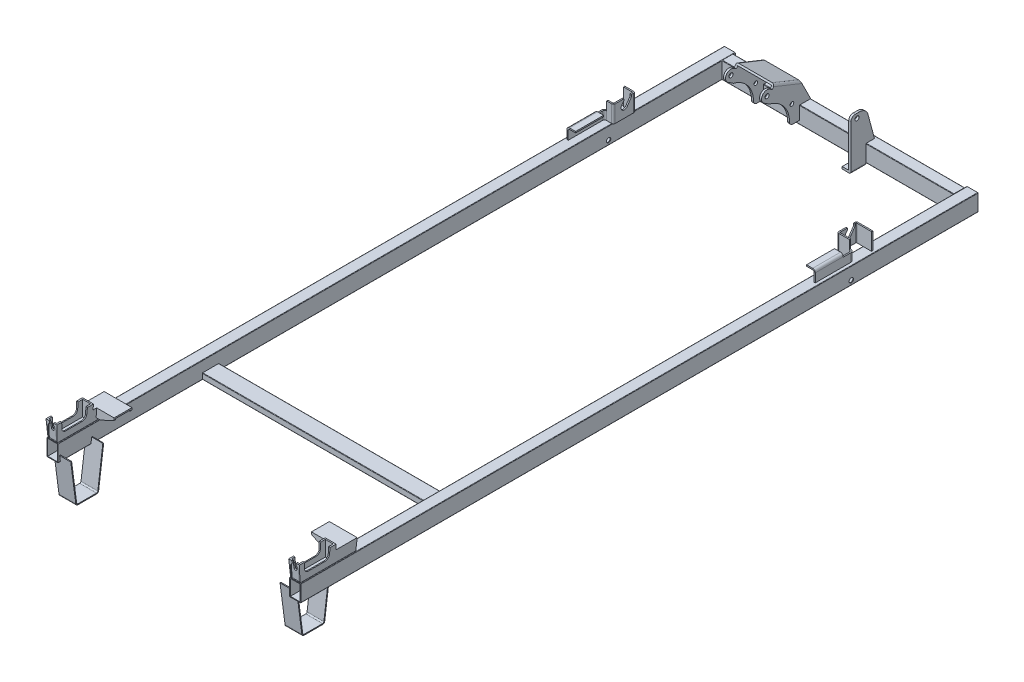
SolidWorks part; units mm, degrees
ref_plane "Plan de face" through (0, 0, 0) normal (0, 0, 1) x (1, 0, 0)
ref_plane "Plan de dessus" through (0, 0, 0) normal (0, 1, 0) x (1, 0, 0)
ref_plane "Plan de droite" through (0, 0, 0) normal (1, 0, 0) x (0, 0, -1)
sketch "Esquisse1" plane through (0, 0, 0) normal (0, 0, 1) x (1, 0, 0)
  line L1 (-11.75, -19.25) -> (11.75, -19.25)
  line L2 (-12.75, -18.25) -> (-12.75, 18.25)
  line L3 (-11.75, 19.25) -> (11.75, 19.25)
  line L4 (12.75, -18.25) -> (12.75, 18.25)
  arc A0 (-12.75, 18.25) -> (-11.75, 19.25) centre (-11.75, 18.25) cw
  arc A1 (11.75, 19.25) -> (12.75, 18.25) centre (11.75, 18.25) cw
  arc A2 (11.75, -19.25) -> (12.75, -18.25) centre (11.75, -18.25) ccw
  arc A3 (-11.75, -19.25) -> (-12.75, -18.25) centre (-11.75, -18.25) cw
  point P7 (-12.75, 19.25)
  point P10 (12.75, 19.25)
  point P13 (12.75, -19.25)
  dimension "D5" = 1
  dimension "D1" = 25.5
  dimension "D2" = 38.5
  dimension "D3" = 12.75
  dimension "D4" = 19.25
extrude "Longueur" add sketch "Esquisse1" against normal blind 1550 thin
sketch "Esquisse2" plane through (12.75, 0, 0) normal (1, 0, 0) x (0, 0, -1)
  line L0 (1550, 19.25) -> (0, 19.25) construction
  line L1 (1544, 19.25) -> (1520.5, 19.25)
  line L2 (1545, 18.25) -> (1545, -18.25)
  line L3 (1544, -19.25) -> (1520.5, -19.25)
  line L4 (1519.5, 18.25) -> (1519.5, -18.25)
  line L5 (1550, -19.25) -> (0, -19.25) construction
  line L7 (1550, -18.25) -> (1550, 18.25) construction
  arc A0 (1520.5, 19.25) -> (1519.5, 18.25) centre (1520.5, 18.25) ccw
  arc A1 (1544, 19.25) -> (1545, 18.25) centre (1544, 18.25) cw
  arc A2 (1545, -18.25) -> (1544, -19.25) centre (1544, -18.25) cw
  arc A3 (1520.5, -19.25) -> (1519.5, -18.25) centre (1520.5, -18.25) cw
  point P12 (1519.5, 19.25)
  point P15 (1545, 19.25)
  point P20 (1519.5, -19.25)
  dimension "D3" = 1
  dimension "D1" = 5
  dimension "D2" = 25.5
extrude "Largeur" add sketch "Esquisse2" along normal blind 265 thin
sketch "Esquisse4" plane through (12.75, 0, 0) normal (1, 0, 0) x (0, 0, -1)
  line L0 (77, -19.25) -> (67.1761, -94.8939)
  line L1 (1550, -19.25) -> (0, -19.25) construction
  line L2 (62.2178, -99.25) -> (19.7822, -99.25)
  line L3 (14.8239, -94.8939) -> (3.3117, -6.25)
  line L4 (5, 28.054) -> (5, -42.7395) construction
  line L5 (0, 18.25) -> (0, -18.25) construction
  line L6 (41, -99.25) -> (41, -19.25) construction
  line L7 (77, -19.25) -> (78.6883, -6.25)
  arc A0 (62.2178, -99.25) -> (67.1761, -94.8939) centre (62.2178, -94.25) ccw
  arc A1 (19.7822, -99.25) -> (14.8239, -94.8939) centre (19.7822, -94.25) cw
  point P10 (5, -19.25)
  point P18 (0, 19.25)
  dimension "D5" = 5
  dimension "D1" = 5
  dimension "D2" = 72
  dimension "D3" = 80
  dimension "D4" = 93
extrude "Pied arrière" add sketch "Esquisse4" along normal blind 25.5 thin
sketch "Esquisse5" plane through (12.75, 0, 0) normal (-1, 0, 0) x (0, 0, 1)
  line L8 (-14.8239, -94.8939) -> (-4.8701, -18.25)
  line L9 (-4.8701, -18.25) -> (-6.8869, -18.25)
  line L10 (-6.8869, -18.25) -> (-16.8072, -94.6364)
  line L11 (-19.7822, -97.25) -> (-62.2178, -97.25)
  line L12 (-65.1928, -94.6364) -> (-75.1131, -18.25)
  line L13 (-4.8701, -18.25) -> (-6.8869, -18.25)
  line L14 (-77.1299, -18.25) -> (-67.1761, -94.8939)
  line L15 (-62.2178, -99.25) -> (-19.7822, -99.25)
  line L16 (-14.8239, -94.8939) -> (-4.8701, -18.25)
  line L17 (-75.1131, -18.25) -> (-77.1299, -18.25)
  line L18 (-6.8869, -18.25) -> (-16.8072, -94.6364)
  line L19 (-19.7822, -97.25) -> (-62.2178, -97.25)
  line L20 (-65.1928, -94.6364) -> (-75.1131, -18.25)
  line L21 (-75.1131, -18.25) -> (-77.1299, -18.25)
  line L22 (-77.1299, -18.25) -> (-67.1761, -94.8939)
  line L23 (-62.2178, -99.25) -> (-19.7822, -99.25)
  arc A4 (-19.7822, -97.25) -> (-16.8072, -94.6364) centre (-19.7822, -94.25) ccw
  arc A5 (-65.1928, -94.6364) -> (-62.2178, -97.25) centre (-62.2178, -94.25) ccw
  arc A6 (-67.1761, -94.8939) -> (-62.2178, -99.25) centre (-62.2178, -94.25) ccw
  arc A7 (-19.7822, -99.25) -> (-14.8239, -94.8939) centre (-19.7822, -94.25) ccw
  arc A8 (-19.7822, -97.25) -> (-16.8072, -94.6364) centre (-19.7822, -94.25) ccw
  arc A9 (-65.1928, -94.6364) -> (-62.2178, -97.25) centre (-62.2178, -94.25) ccw
  arc A10 (-67.1761, -94.8939) -> (-62.2178, -99.25) centre (-62.2178, -94.25) ccw
  arc A11 (-19.7822, -99.25) -> (-14.8239, -94.8939) centre (-19.7822, -94.25) ccw
  dimension "D1" = 0
extrude "Pied arrière2" add sketch "Esquisse5" along normal blind 13
sketch "Esquisse6" plane through (0, 0, 0) normal (1, 0, 0) x (0, 0, -1)
  line L0 (0, 19.25) -> (-2.6572, 57.25)
  line L1 (129.8181, 45.25) -> (80.8181, 45.25)
  line L2 (129.8181, 45.25) -> (128, 19.25)
  line L3 (1519.5, 19.25) -> (0, 19.25) construction
  line L4 (128, 19.25) -> (0, 19.25)
  line L5 (80.8181, 45.25) -> (80.8181, 57.25)
  line L6 (80.8181, 57.25) -> (67.3428, 57.25)
  line L7 (67.3428, 57.25) -> (66.385, 43.5524)
  line L8 (56.4093, 34.25) -> (19.2762, 34.25)
  line L9 (9.3006, 43.5524) -> (8.3428, 57.25)
  line L10 (8.3428, 57.25) -> (-2.6572, 57.25)
  line L11 (128, 19.25) -> (128, 80.5547) construction
  line L12 (0, 19.25) -> (0, 131.9278) construction
  arc A0 (19.2762, 34.25) -> (9.3006, 43.5524) centre (19.2762, 44.25) cw
  arc A1 (56.4093, 34.25) -> (66.385, 43.5524) centre (56.4093, 44.25) ccw
  dimension "D10" = 10
  dimension "D1" = 128
  dimension "D2" = 26
  dimension "D3" = 49
  dimension "D4" = 38
  dimension "D5" = 4
  dimension "D6" = 4
  dimension "D7" = 59
  dimension "D8" = 15
  dimension "D9" = 11
extrude "Extrusion1" add sketch "Esquisse6" along normal mid plane 21
draft "Dépouille2" type of draft neutral plane draft angle 3 faces to draft 2 parameters "D1"=3
sketch "Esquisse7" plane through (0, 0.0937, -1.3395) normal (0, -0.0698, 0.9976) x (1, 0, 0)
  line L0 (-9.5, 19.2031) -> (-9, 44.3818)
  line L1 (10.5, 19.2031) -> (-10.5, 19.2031) construction
  line L2 (9.5, 19.2031) -> (9, 44.3818)
  line L3 (0, 19.2031) -> (0, 49.1783) construction
  line L4 (9.5, 19.2031) -> (-9.5, 19.2031)
  arc A0 (9, 44.3818) -> (-9, 44.3818) centre (0, 44.2031) ccw
  dimension "D1" = 19
  dimension "D2" = 18
  dimension "D3" = 25
extrude "Enlèv. mat.-Extru.1" cut sketch "Esquisse7" against normal blind 2
sketch "Esquisse8" plane through (0, 0, 0) normal (1, 0, 0) x (0, 0, -1)
  line L0 (67.3428, 57.25) -> (66.385, 43.5524) construction
  line L1 (56.4093, 34.25) -> (19.2762, 34.25) construction
  line L2 (9.3006, 43.5524) -> (8.3428, 57.25) construction
  line L3 (67.3428, 57.25) -> (66.385, 43.5524)
  line L4 (56.4093, 34.25) -> (19.2762, 34.25)
  line L5 (9.3006, 43.5524) -> (8.3428, 57.25)
  line L6 (80.8181, 57.25) -> (67.3428, 57.25) construction
  line L7 (8.3428, 57.25) -> (-2.6572, 57.25) construction
  line L8 (77.8181, 57.25) -> (67.3428, 57.25)
  line L9 (8.3428, 57.25) -> (0.3501, 57.25)
  line L14 (77.8181, 57.25) -> (77.8181, 22.25)
  line L15 (0.3355, 57.4593) -> (2.9927, 19.4593)
  line L16 (0.3501, 57.25) -> (2.7975, 22.25)
  line L18 (80.8181, 45.25) -> (80.8181, 57.25) construction
  line L19 (1550, 22.25) -> (0, 22.25)
  line L20 (77.8181, 22.25) -> (2.7975, 22.25)
  arc A0 (56.4093, 34.25) -> (66.385, 43.5524) centre (56.4093, 44.25) ccw construction
  arc A1 (9.3006, 43.5524) -> (19.2762, 34.25) centre (19.2762, 44.25) ccw construction
  arc A2 (56.4093, 34.25) -> (66.385, 43.5524) centre (56.4093, 44.25) ccw
  arc A3 (9.3006, 43.5524) -> (19.2762, 34.25) centre (19.2762, 44.25) ccw
  dimension "D3" = 3
  dimension "D1" = 3
  dimension "D2" = 3
extrude "Support rouleau arrière" cut sketch "Esquisse8" against normal mid plane 18
sketch "Esquisse9" plane through (0, 0.3029, -4.3322) normal (0, 0.0698, -0.9976) x (-1, 0, 0)
  line L0 (-9, 57.0861) -> (-9, 22.0007) construction
  line L1 (9, 22.0007) -> (-9, 22.0007) construction
  line L2 (9, 57.0861) -> (9, 22.0007) construction
  line L3 (-9, 44.3818) -> (-9, 22.0007)
  line L4 (9, 22.0007) -> (-9, 22.0007)
  line L5 (9, 44.3818) -> (9, 22.0007)
  arc A0 (9, 44.3818) -> (-9, 44.3818) centre (0, 44.2031) ccw construction
  arc A1 (9, 44.3818) -> (-9, 44.3818) centre (0, 44.2031) ccw
extrude "Extrusion2" add sketch "Esquisse9" along normal blind 2
sketch "Esquisse12" plane through (0, 0, 0) normal (1, 0, 0) x (0, 0, -1)
  line L0 (3.6137, 39.25) -> (14.8024, 22.25)
  line L1 (3.2314, 44.7162) -> (4.7927, 22.3895) construction
  line L2 (2.7975, 22.25) -> (77.8181, 22.25) construction
  line L3 (14.8024, 22.25) -> (4.8024, 22.25)
  line L4 (3.6137, 39.25) -> (4.8024, 22.25)
  dimension "D1" = 17
  dimension "D2" = 10
extrude "Extrusion3" add sketch "Esquisse12" along normal mid plane 2
sketch "Esquisse13" plane through (0, 0.2332, -3.3347) normal (0, -0.0698, 0.9976) x (1, 0, 0)
  line L0 (5, 57.2959) -> (2.9756, 41.5205)
  line L1 (12.4915, 57.2959) -> (-12.4915, 57.2959) construction
  line L2 (-5, 57.2959) -> (-2.9756, 41.5205)
  line L3 (0, 57.2959) -> (0, 34.2193) construction
  line L4 (-5, 57.2959) -> (5, 57.2959)
  line L5 (1, 38.9023) -> (-1, 38.9023) construction
  arc A0 (-2.9756, 41.5205) -> (2.9756, 41.5205) centre (0, 41.9023) ccw
  dimension "D1" = 3
  dimension "D2" = 10
extrude "Enlèv. mat.-Extru.3" cut sketch "Esquisse13" against normal up to surface and the other way through all
sketch "Esquisse14" plane through (0, 45.25, 0) normal (0, 1, 0) x (1, 0, 0)
  line L0 (10.8626, 129.8181) -> (51.8626, 129.8181)
  line L2 (51.8626, 129.8181) -> (51.8626, 88.8181)
  line L3 (51.8626, 88.8181) -> (10.8626, 88.8181)
  line L7 (10.8626, 129.8181) -> (10.8626, 80.8181)
  line L8 (10.8626, 129.8181) -> (10.8626, 88.8181)
  dimension "D1" = 41
  dimension "D2" = 41
  dimension "D3" = 1
extrude "Extrusion4" add sketch "Esquisse14" against normal blind 3
sketch "Esquisse15" plane through (0, 0, -88.8181) normal (0, 0, 1) x (1, 0, 0)
  line L0 (12.4915, 57.25) -> (10.5, 19.25) construction
  line L1 (10.8144, 25.25) -> (20.8144, 25.25)
  line L2 (20.8144, 25.25) -> (51.8626, 40.25)
  line L3 (51.8626, 40.25) -> (51.8626, 42.25)
  line L4 (11.8626, 45.25) -> (51.8626, 45.25) construction
  line L5 (11.7054, 42.25) -> (51.8626, 42.25) construction
  line L6 (11.7054, 42.25) -> (51.8626, 42.25)
  line L7 (11.7054, 42.25) -> (10.8144, 25.25)
  dimension "D1" = 20
  dimension "D2" = 5
  dimension "D3" = 10
extrude "Extrusion5" add sketch "Esquisse15" against normal blind 3
ref_point "Point1"
ref_plane "Plan2" through (0, 0, -109.3181) normal (0, 0, -1) x (-1, 0, 0)
mirror "Symétrie2" about plane through (0, 0, -109.3181) normal (0, 0, -1) of "Extrusion5"
sketch "Esquisse17" plane through (10.8626, 0, 0) normal (-1, 0, 0) x (0, 0, 1)
  line L1 (-128.4196, 25.25) -> (-129.8181, 25.25) construction
  line L2 (-128.4196, 25.25) -> (-129.8181, 25.25)
  line L3 (-129.6083, 42.25) -> (-129.8181, 45.25)
  line L4 (-129.8181, 45.25) -> (-129.8181, 42.25)
  line L5 (-129.8181, 42.25) -> (-129.6083, 42.25)
  line L6 (-128.4196, 25.25) -> (-129.8181, 45.25)
  line L7 (-129.8181, 45.25) -> (-129.8181, 25.25)
  dimension "D1" = 0
extrude "Enlèv. mat.-Extru.4" cut sketch "Esquisse17" against normal through all and the other way through all
sketch "Esquisse18" plane through (12.75, 0, 0) normal (1, 0, 0) x (0, 0, -1)
  line L0 (0, -18.25) -> (0, 18.25) construction
  line L1 (331, -5.75) -> (367, -5.75)
  line L2 (330, -6.75) -> (330, -17.75)
  line L3 (331, -18.75) -> (367, -18.75)
  line L4 (368, -6.75) -> (368, -17.75)
  line L5 (1550, 19.25) -> (0, 19.25) construction
  arc A0 (331, -5.75) -> (330, -6.75) centre (331, -6.75) ccw
  arc A1 (367, -5.75) -> (368, -6.75) centre (367, -6.75) cw
  arc A2 (367, -18.75) -> (368, -17.75) centre (367, -17.75) ccw
  arc A3 (330, -17.75) -> (331, -18.75) centre (331, -17.75) ccw
  point P4 (0, 0)
  point P11 (330, -5.75)
  point P14 (368, -5.75)
  point P19 (330, -18.75)
  dimension "D5" = 1
  dimension "D1" = 330
  dimension "D2" = 25
  dimension "D3" = 13
  dimension "D4" = 38
extrude "Barre de renfort" add sketch "Esquisse18" along normal up to surface (265 mm away) thin
sketch "Esquisse19" plane through (0, 19.25, 0) normal (0, 1, 0) x (1, 0, 0)
  line L0 (-4.75, 1185) -> (-4.75, 1263)
  line L1 (0.25, 1268) -> (11.75, 1268)
  line L2 (15.75, 1272) -> (15.75, 1314)
  line L3 (11.75, 1318) -> (-8.25, 1318)
  line L4 (-9.5, 0) -> (9.5, 0) construction
  line L5 (-12.75, 1550) -> (-12.75, 0) construction
  line L6 (12.75, 1519.5) -> (12.75, 0) construction
  arc A1 (-4.75, 1263) -> (0.25, 1268) centre (0.25, 1263) cw
  arc A2 (11.75, 1268) -> (15.75, 1272) centre (11.75, 1272) ccw
  arc A3 (11.75, 1318) -> (15.75, 1314) centre (11.75, 1314) cw
  point P2 (0, 0)
  point P22 (15.75, 1318)
  dimension "D6" = 24
  dimension "D7" = 5
  dimension "D8" = 4
  dimension "D1" = 1185
  dimension "D2" = 133
  dimension "D3" = 50
  dimension "D4" = 8
  dimension "D5" = 3
extrude "Support rouleau avant" add sketch "Esquisse19" along normal blind 19 thin
sketch "Esquisse21" plane through (0, 38.25, 0) normal (0, 1, 0) x (1, 0, 0)
  line L0 (0.25, 1268) -> (11.75, 1268) construction
  line L1 (15.75, 1272) -> (15.75, 1314) construction
  line L2 (11.75, 1318) -> (-8.25, 1318) construction
  line L3 (0.25, 1268) -> (11.75, 1268)
  line L4 (15.75, 1272) -> (15.75, 1314)
  line L5 (11.75, 1318) -> (-8.25, 1318)
  arc A0 (11.75, 1268) -> (15.75, 1272) centre (11.75, 1272) ccw construction
  arc A1 (15.75, 1314) -> (11.75, 1318) centre (11.75, 1314) ccw construction
  arc A2 (11.75, 1268) -> (15.75, 1272) centre (11.75, 1272) ccw
  arc A3 (15.75, 1314) -> (11.75, 1318) centre (11.75, 1314) ccw
extrude "Extru.-Mince4" add sketch "Esquisse21" along normal blind 20 thin
ref_plane "Plan Médian" through (277.75, 0, 0) normal (1, 0, 0) x (0, 0, -1)
mirror "Symétrie4" about plane through (277.75, 18.25, -1520.5) normal (1, 0, 0) of "Longueur", "Largeur", "Pied arrière", "Pied arrière2", "Extrusion1", "Dépouille2", "Enlèv. mat.-Extru.1", "Support rouleau arrière", "Extrusion2", "Extrusion3", "Enlèv. mat.-Extru.3", "Extrusion4", "Extrusion5", "Symétrie2", "Enlèv. mat.-Extru.4", "Barre de renfort"
ref_plane "Plan3" through (103.25, 0, 0) normal (-1, 0, 0) x (0, 0, 1)
sketch "Esquisse23" plane through (103.25, 0, 0) normal (-1, 0, 0) x (0, 0, 1)
  line L0 (-1545, 19.25) -> (-1525, 59.25)
  line L1 (-1525, 59.25) -> (-1460.0292, 85.3038)
  line L2 (-1460.0292, 85.3038) -> (-1457.2778, 81.1289)
  line L3 (-1457.2778, 81.1289) -> (-1451.8785, 84.6872)
  line L4 (-1438.1215, 63.8128) -> (-1450.6462, 55.5585)
  line L5 (-1519.5, -10.75) -> (-1504.5, -10.75)
  line L6 (-1519.5, 18.25) -> (-1519.5, -18.25) construction
  line L8 (-1550, 19.25) -> (0, 19.25) construction
  line L9 (-1545, 19.25) -> (-1520.5, 19.25)
  line L10 (-1519.5, -10.75) -> (-1519.5, 18.25)
  line L11 (-1545, -18.25) -> (-1545, 18.25) construction
  arc A0 (-1438.1215, 63.8128) -> (-1451.8785, 84.6872) centre (-1445, 74.25) ccw
  arc A1 (-1450.6462, 55.5585) -> (-1496.5, -2.75) centre (-1436.5, -2.75) ccw
  arc A2 (-1496.5, -2.75) -> (-1504.5, -10.75) centre (-1504.5, -2.75) cw
  circle A3 centre (-1445, 74.25) radius 4.75
  circle A4 centre (-1502, 30.2614) radius 4.25
  arc A5 (-1519.5, 18.25) -> (-1520.5, 19.25) centre (-1520.5, 18.25) ccw construction
  arc A6 (-1519.5, 18.25) -> (-1520.5, 19.25) centre (-1520.5, 18.25) ccw
  dimension "D1" = 12.5
  dimension "D10" = 8
  dimension "D11" = 60
  dimension "D14" = 9.5
  dimension "D17" = 8.5
  dimension "D2" = 100
  dimension "D3" = 55
  dimension "D4" = 20
  dimension "D5" = 40
  dimension "D6" = 70
  dimension "D7" = 5
  dimension "D8" = 15
  dimension "D9" = 30
  dimension "D12" = 15
  dimension "D13" = 108.5
  dimension "D15" = 43
  dimension "D16" = 72
extrude "Support moteur" add sketch "Esquisse23" against normal blind 4.5
ref_plane "Plan4" through (146.75, 0, 0) normal (-1, 0, 0) x (0, 0, 1)
mirror "Symétrie5" about plane through (146.75, 0, 0) normal (-1, 0, 0) of "Support moteur"
ref_plane "Plan5" through (0, -492.5588, -1228.3017) normal (0, 0.3722, 0.9282) x (1, 0, 0)
sketch "Esquisse24" plane through (0, -492.5588, -1228.3017) normal (0, 0.3722, 0.9282) x (1, 0, 0)
  line L0 (108.25, 627.6946) -> (185.25, 627.6946)
  line L1 (103.25, 622.5937) -> (103.25, 622.6946)
  line L2 (190.25, 622.5937) -> (190.25, 622.6946)
  arc A0 (103.25, 622.6946) -> (108.25, 627.6946) centre (108.25, 622.6946) cw
  arc A1 (190.25, 622.6946) -> (185.25, 627.6946) centre (185.25, 622.6946) ccw
  dimension "D2" = 5
  dimension "D1" = 10
extrude "Extru.-Mince5" add sketch "Esquisse24" against normal up to surface (64.2513 mm away) thin
ref_plane "Plan6" through (337.25, 0, 0) normal (-1, 0, 0) x (0, 0, 1)
sketch "Esquisse25" plane through (337.25, 0, 0) normal (-1, 0, 0) x (0, 0, 1)
  line L0 (-1485, 79.25) -> (-1485, -19.25)
  line L1 (-1545, -18.25) -> (-1545, 18.25) construction
  line L2 (-1504.897, 89.25) -> (-1495, 89.25)
  line L3 (-1550, 19.25) -> (0, 19.25) construction
  line L4 (-1539, 19.25) -> (-1524.2155, 74.4264)
  line L5 (-1550, -19.25) -> (0, -19.25) construction
  line L6 (-1485, -19.25) -> (-1520.5, -19.25)
  line L7 (-1519.5, 18.25) -> (-1519.5, -18.25)
  line L9 (-1539, 19.25) -> (-1520.5, 19.25)
  circle A0 centre (-1499, 79.25) radius 4.75
  arc A1 (-1519.5, 18.25) -> (-1520.5, 19.25) centre (-1520.5, 18.25) ccw construction
  arc A2 (-1519.5, 18.25) -> (-1520.5, 19.25) centre (-1520.5, 18.25) ccw
  arc A3 (-1520.5, -19.25) -> (-1519.5, -18.25) centre (-1520.5, -18.25) ccw construction
  arc A4 (-1520.5, -19.25) -> (-1519.5, -18.25) centre (-1520.5, -18.25) ccw
  arc A5 (-1485, 79.25) -> (-1495, 89.25) centre (-1495, 79.25) ccw
  arc A6 (-1524.2155, 74.4264) -> (-1504.897, 89.25) centre (-1504.897, 69.25) cw
  dimension "D6" = 9.5
  dimension "D8" = 10
  dimension "D9" = 20
  dimension "D1" = 60
  dimension "D2" = 70
  dimension "D3" = 6
  dimension "D4" = 75
  dimension "D5" = 60
  dimension "D7" = 46
extrude "support vérin" add sketch "Esquisse25" against normal blind 5
sketch "Esquisse26" plane through (0, 0, -1485) normal (0, 0, 1) x (1, 0, 0)
  line L0 (342.25, -19.25) -> (342.25, -20.25)
  line L2 (338.25, -24.25) -> (322.25, -24.25)
  line L3 (542.75, -19.25) -> (342.25, -19.25) construction
  arc A0 (342.25, -20.25) -> (338.25, -24.25) centre (338.25, -20.25) cw
  point P4 (342.25, -24.25)
  dimension "D2" = 4
  dimension "D1" = 20
  dimension "D3" = 5
extrude "Extru.-Mince7" add sketch "Esquisse26" against normal up to surface (34.5 mm away) thin
sketch "Esquisse27" plane through (0, 19.25, 0) normal (0, 1, 0) x (1, 0, 0)
  line L0 (557.75, 1185) -> (557.75, 1266)
  line L1 (552.75, 1271) -> (528.75, 1271)
  line L2 (524.75, 1275) -> (524.75, 1311)
  line L3 (528.75, 1315) -> (562.75, 1315)
  line L4 (11.75, 1315) -> (-8.25, 1315) construction
  line L5 (0.25, 1271) -> (11.75, 1271) construction
  line L6 (12.75, 1272) -> (12.75, 1314) construction
  line L7 (542.75, 1519.5) -> (542.75, 0) construction
  arc A0 (524.75, 1311) -> (528.75, 1315) centre (528.75, 1311) cw
  arc A1 (528.75, 1271) -> (524.75, 1275) centre (528.75, 1275) cw
  arc A2 (557.75, 1266) -> (552.75, 1271) centre (552.75, 1266) ccw
  point P16 (524.75, 1315)
  dimension "D4" = 4
  dimension "D5" = 5
  dimension "D1" = 512
  dimension "D2" = 38
  dimension "D3" = 15
extrude "Extru.-Mince8" add sketch "Esquisse27" along normal up to surface (19 mm away) thin
sketch "Esquisse20" plane through (0, 0, -1185) normal (0, 0, 1) x (1, 0, 0)
  line L3 (-7.75, 38.25) -> (-7.75, 39.25)
  line L4 (12.25, 45.25) -> (-1.75, 45.25)
  line L5 (-4.75, 19.25) -> (-7.75, 19.25) construction
  line L6 (-7.75, 38.25) -> (-7.75, 19.25) construction
  arc A0 (-7.75, 39.25) -> (-1.75, 45.25) centre (-1.75, 39.25) cw
  dimension "D1" = 6
  dimension "D4" = 26
  dimension "D5" = 20
extrude "Extru.-Mince3" add sketch "Esquisse20" against normal blind 64 thin
sketch "Esquisse28" plane through (0, 0, -1185) normal (0, 0, 1) x (1, 0, 0)
  line L0 (560.75, 38.25) -> (560.75, 39.25)
  line L1 (554.75, 45.25) -> (540.75, 45.25)
  line L2 (12.25, 45.25) -> (-1.75, 45.25) construction
  arc A0 (560.75, 39.25) -> (554.75, 45.25) centre (554.75, 39.25) ccw
  dimension "D1" = 6
  dimension "D2" = 20
extrude "Extru.-Mince9" add sketch "Esquisse28" against normal up to surface (64 mm away) thin
sketch "Esquisse29" plane through (0, 38.25, 0) normal (0, 1, 0) x (1, 0, 0)
  line L0 (552.75, 1271) -> (528.75, 1271) construction
  line L1 (524.75, 1275) -> (524.75, 1311) construction
  line L2 (528.75, 1315) -> (562.75, 1315) construction
  line L3 (552.75, 1271) -> (528.75, 1271)
  line L4 (524.75, 1275) -> (524.75, 1311)
  line L5 (528.75, 1315) -> (562.75, 1315)
  arc A0 (524.75, 1275) -> (528.75, 1271) centre (528.75, 1275) ccw construction
  arc A1 (528.75, 1315) -> (524.75, 1311) centre (528.75, 1311) ccw construction
  arc A2 (524.75, 1275) -> (528.75, 1271) centre (528.75, 1275) ccw
  arc A3 (528.75, 1315) -> (524.75, 1311) centre (528.75, 1311) ccw
extrude "Extru.-Mince10" add sketch "Esquisse29" along normal up to surface (20 mm away) thin
sketch "Esquisse22" plane through (15.75, 0, 0) normal (1, 0, 0) x (0, 0, -1)
  line L0 (1286.8244, 47.5059) -> (1291.6468, 54.5034)
  line L1 (1299.1756, 38.9941) -> (1307.9404, 51.7125)
  line L2 (1309, 55.1172) -> (1309, 58.25)
  line L3 (1272, 58.25) -> (1314, 58.25) construction
  line L4 (1292, 55.6383) -> (1292, 57.25)
  line L5 (1293, 58.25) -> (1293, 20.9157) construction
  line L6 (1318, 58.25) -> (1318, 19.25) construction
  line L7 (1291, 58.25) -> (1309, 58.25)
  line L8 (1550, 19.25) -> (0, 19.25) construction
  arc A0 (1286.8244, 47.5059) -> (1299.1756, 38.9941) centre (1293, 43.25) ccw
  arc A1 (1307.9404, 51.7125) -> (1309, 55.1172) centre (1303, 55.1172) ccw
  arc A2 (1291.6468, 54.5034) -> (1292, 55.6383) centre (1290, 55.6383) ccw
  arc A3 (1292, 57.25) -> (1291, 58.25) centre (1291, 57.25) ccw
  point P16 (1309, 53.25)
  point P22 (1292.918, 58.25)
  dimension "D1" = 15
  dimension "D5" = 6
  dimension "D6" = 2
  dimension "D7" = 1
  dimension "D2" = 24
  dimension "D3" = 9
  dimension "D4" = 5
  dimension "D8" = 17
extrude "Enlèv. mat.-Extru.5" cut sketch "Esquisse22" against normal through all and the other way through all
sketch "Esquisse30" plane through (-12.75, 0, 0) normal (-1, 0, 0) x (0, 0, 1)
  line L0 (-1550, -19.25) -> (0, -19.25) construction
  line L1 (-1550, 18.25) -> (-1550, -18.25) construction
  circle A0 centre (-1260, -9.25) radius 5
  dimension "D1" = 10
  dimension "D2" = 10
  dimension "D3" = 290
extrude "Enlèv. mat.-Extru.6" cut sketch "Esquisse30" against normal through all
